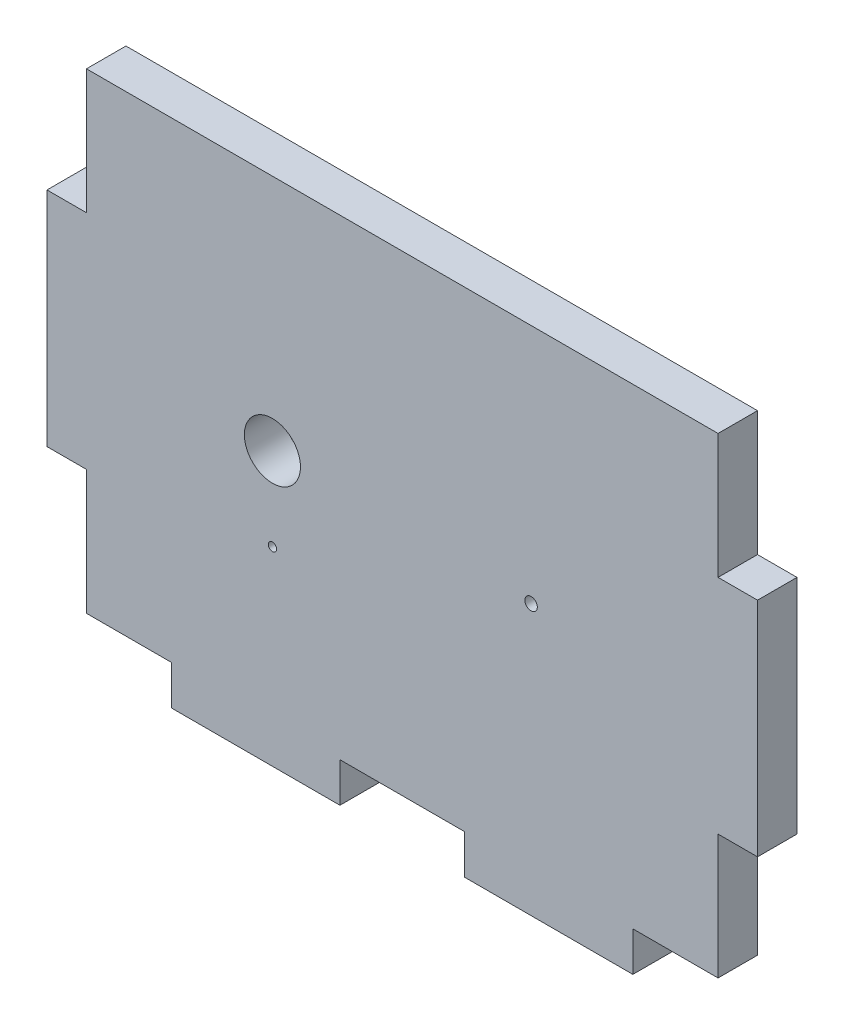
SolidWorks part; units mm, degrees
ref_plane "Plan de face" through (0, 0, 0) normal (0, 0, 1) x (1, 0, 0)
ref_plane "Plan de dessus" through (0, 0, 0) normal (0, 1, 0) x (1, 0, 0)
ref_plane "Plan de droite" through (0, 0, 0) normal (1, 0, 0) x (0, 0, -1)
sketch "Esquisse1" plane through (0, 0, 0) normal (0, 0, 1) x (1, 0, 0)
  line L1 (-171, 123) -> (171, 123)
  line L2 (-171, 123) -> (-171, -123)
  line L3 (-171, -123) -> (171, -123)
  line L4 (171, 123) -> (171, -123)
  line L5 (-171, 123) -> (171, -123) construction
  line L6 (-171, -123) -> (171, 123) construction
  point P0 (0, 0)
  dimension "D1" = 342
  dimension "D2" = 246
extrude "Boss.-Extru.1" add sketch "Esquisse1" along normal mid plane 19
sketch "Esquisse2" plane through (0, 0, 9.5) normal (0, 0, 1) x (1, 0, 0)
  line L1 (171, -123) -> (111, -123)
  line L2 (171, -123) -> (171, -104)
  line L3 (171, -104) -> (111, -104)
  line L4 (111, -123) -> (111, -104)
  dimension "D1" = 60
  dimension "D2" = 19
extrude "Enlèv. mat.-Extru.1" cut sketch "Esquisse2" against normal up to next
pattern_linear "Répétition linéaire1" count 3 spacing 141 along (-1, 0, 0) of "Enlèv. mat.-Extru.1"
sketch "Esquisse3" plane through (0, 0, 9.5) normal (0, 0, 1) x (1, 0, 0)
  line L0 (111, -104) -> (111, -123) construction
  line L1 (171, -104) -> (152, -104)
  line L2 (171, -104) -> (171, -44)
  line L3 (171, -44) -> (152, -44)
  line L4 (152, -104) -> (152, -44)
  line L5 (171, -104) -> (111, -104) construction
extrude "Enlèv. mat.-Extru.2" cut sketch "Esquisse3" against normal up to next
pattern_linear "Répétition linéaire2" count 2 spacing 323 along (-1, 0, 0) count 2 spacing 167 along (0, 1, 0) of "Enlèv. mat.-Extru.2"
sketch "Esquisse4" plane through (0, 0, 9.5) normal (0, 0, 1) x (1, 0, 0)
  line L0 (-171, 9.5) -> (-76.0053, 8.4994) construction
  line L1 (-171, 63) -> (-171, -44) construction
  line L2 (-49.0041, 8.4994) -> (-171, 9.5) construction
  line L3 (-62.5047, 22) -> (-62.5047, 123) construction
  line L4 (152, 123) -> (-152, 123) construction
  line L5 (62.006, 7.0457) -> (171, 5.8977) construction
  line L7 (171, -44) -> (171, 63) construction
  circle A0 centre (-62.5047, 8.4994) radius 13.5006
  circle A1 centre (62.006, 7.0457) radius 3
  circle A2 centre (-62.5047, -31.5006) radius 2
  dimension "D4" = 6
  dimension "D6" = 4
  dimension "D1" = 122
  dimension "D2" = 95
  dimension "D3" = 101
  dimension "D5" = 109
  dimension "D7" = 40
extrude "Enlèv. mat.-Extru.3" cut sketch "Esquisse4" against normal up to next
